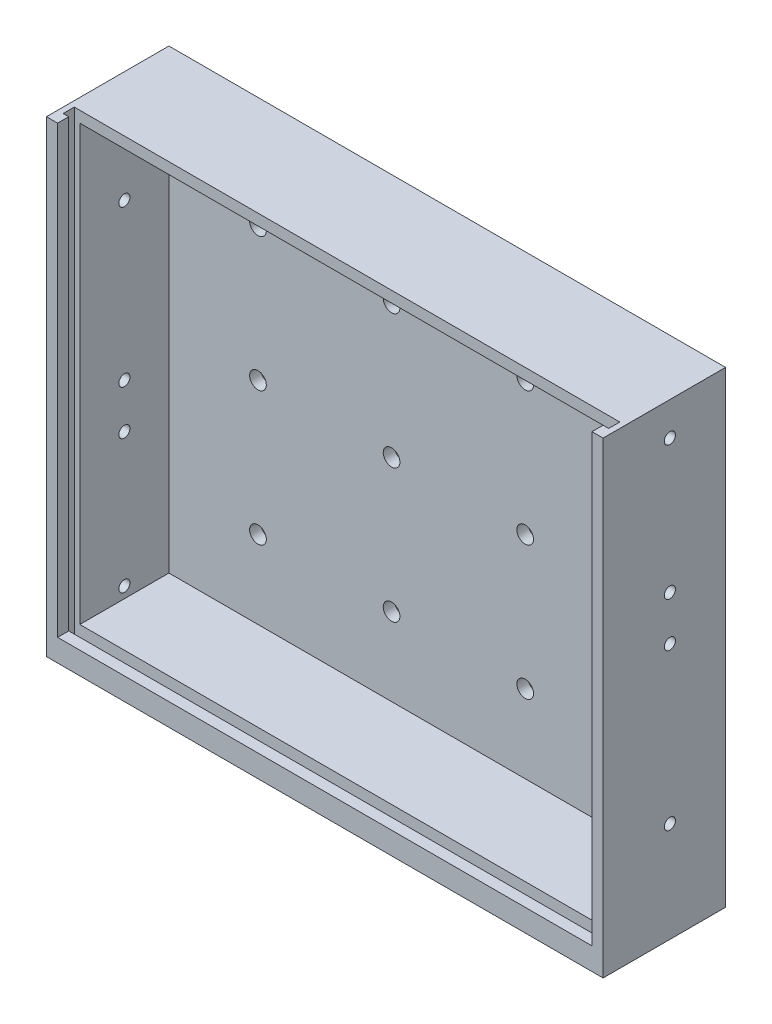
SolidWorks part; units mm, degrees
ref_plane "Front Plane" through (0, 0, 0) normal (0, 0, 1) x (1, 0, 0)
ref_plane "Top Plane" through (0, 0, 0) normal (0, 1, 0) x (1, 0, 0)
ref_plane "Right Plane" through (0, 0, 0) normal (1, 0, 0) x (0, 0, -1)
sketch "Sketch1" plane through (0, 0, 0) normal (0, 0, 1) x (1, 0, 0)
  line L1 (0, 0) -> (317.5, 0)
  line L2 (0, 0) -> (0, -266.7)
  line L3 (0, -266.7) -> (317.5, -266.7)
  line L4 (317.5, 0) -> (317.5, -266.7)
  dimension "D1" = 317.5
  dimension "D2" = 266.7
extrude "Boss-Extrude2" add sketch "Sketch1" along normal blind 6.35
sketch "Sketch4" plane through (0, 0, 6.35) normal (0, 0, 1) x (1, 0, 0)
  line L0 (6.35, 0) -> (6.35, -254)
  line L1 (317.5, 0) -> (0, 0) construction
  line L2 (311.15, -254) -> (311.15, 0)
  line L3 (317.5, 0) -> (317.5, -266.7)
  line L4 (317.5, -266.7) -> (0, -266.7)
  line L5 (0, -266.7) -> (0, 0)
  line L6 (0, 0) -> (6.35, 0)
  line L7 (6.35, -254) -> (311.15, -254)
  line L8 (311.15, 0) -> (317.5, 0)
  line L12 (0, 0) -> (0, -266.7)
  line L13 (0, -266.7) -> (317.5, -266.7)
  line L14 (317.5, -266.7) -> (317.5, 0)
  line L15 (317.5, 0) -> (0, 0)
  line L16 (0, 0) -> (0, -266.7)
  line L17 (0, -266.7) -> (317.5, -266.7)
  line L18 (317.5, -266.7) -> (317.5, 0)
  line L19 (311.15, 0) -> (0, 0)
  dimension "D1" = 304.8
  dimension "D2" = 6.35
  dimension "D3" = 254
  dimension "D5" = 6.35
  dimension "D4" = 0
extrude "Boss-Extrude5" add sketch "Sketch4" along normal blind 63.5 contours L7 L0 L2 M11 M8 M9 M10
sketch "Sketch6" plane through (0, 0, 0) normal (0, 1, 0) x (1, 0, 0)
  line L0 (3.175, -63.5) -> (3.175, -57.15)
  line L1 (3.175, -57.15) -> (314.325, -57.15)
  line L2 (314.325, -57.15) -> (314.325, -63.5)
  line L3 (314.325, -63.5) -> (3.175, -63.5)
  line L7 (6.35, -69.85) -> (0, -69.85) construction
  line L8 (0, -69.85) -> (0, 0) construction
  dimension "D1" = 311.15
  dimension "D2" = 6.35
  dimension "D3" = 6.35
  dimension "D4" = 3.175
extrude "Cut-Extrude2" cut sketch "Sketch6" against normal blind 314.325
sketch "Sketch7" plane through (0, 0, 6.35) normal (0, 0, 1) x (1, 0, 0)
  line L0 (0, 0) -> (0, -6.35)
  line L1 (0, 0) -> (0, -266.7) construction
  line L2 (0, -6.35) -> (317.5, -6.35)
  line L3 (317.5, -266.7) -> (317.5, 0) construction
  line L4 (317.5, -6.35) -> (317.5, 0)
  line L5 (317.5, 0) -> (0, 0)
  line L6 (0, -6.35) -> (0, 0)
  dimension "D1" = 6.35
extrude "Boss-Extrude6" add sketch "Sketch7" along normal blind 50.8 contours L2 M6 M4 M5
sketch "Sketch8" plane through (0, 0, 6.35) normal (0, 0, 1) x (1, 0, 0)
  line L0 (6.35, -6.35) -> (6.35, -254) construction
  line L1 (6.35, -6.35) -> (311.15, -6.35) construction
  line L2 (6.35, -6.35) -> (311.15, -6.35) construction
  circle A0 centre (57.15, -57.15) radius 4.7625
  circle A1 centre (209.55, -57.15) radius 4.7625
  circle A3 centre (57.15, -209.55) radius 4.7625
  circle A4 centre (209.55, -209.55) radius 4.7625
  dimension "D1" = 50.8
  dimension "D2" = 50.8
  dimension "D3" = 152.4
  dimension "D4" = 50.8
  dimension "D7" = 152.4
  dimension "D8" = 50.8
  dimension "D9" = 152.4
  dimension "D11" = 152.4
  dimension "D19" = 9.525
extrude "Cut-Extrude3" cut sketch "Sketch8" against normal blind 6.35
sketch "Sketch9" plane through (0, 0, 0) normal (-1, 0, 0) x (0, 0, 1)
  line L0 (69.85, 0) -> (0, 0) construction
  line L2 (0, 0) -> (0, -266.7) construction
  circle A0 centre (31.75, -57.15) radius 3.175
  circle A1 centre (31.75, -146.05) radius 3.175
  circle A2 centre (31.75, -171.45) radius 3.175
  circle A3 centre (31.75, -247.65) radius 3.175
  circle A4 centre (31.75, -273.05) radius 3.175
  dimension "D1" = 57.15
  dimension "D2" = 31.75
  dimension "D3" = 6.35
  dimension "D4" = 25.4
  dimension "D5" = 25.4
  dimension "D6" = 6.35
  dimension "D7" = 6.35
  dimension "D8" = 6.35
  dimension "D9" = 6.35
  dimension "D10" = 88.9
  dimension "D11" = 76.2
  dimension "D12" = 31.75
  dimension "D13" = 31.75
  dimension "D14" = 31.75
  dimension "D15" = 31.75
extrude "Cut-Extrude4" cut sketch "Sketch9" against normal blind 6.35
sketch "Sketch10" plane through (317.5, 0, 0) normal (1, 0, 0) x (0, 0, -1)
  line L0 (-69.85, -266.7) -> (0, -266.7) construction
  line L2 (0, -266.7) -> (0, 0) construction
  circle A0 centre (-31.75, -209.55) radius 3.175
  circle A1 centre (-31.75, -120.65) radius 3.175
  circle A2 centre (-31.75, -95.25) radius 3.175
  circle A3 centre (-31.75, -19.05) radius 3.175
  circle A4 centre (-31.75, 6.35) radius 3.175
  dimension "D1" = 57.15
  dimension "D2" = 31.75
  dimension "D3" = 6.35
  dimension "D4" = 6.35
  dimension "D5" = 6.35
  dimension "D6" = 6.35
  dimension "D7" = 6.35
  dimension "D8" = 146.05
  dimension "D9" = 25.4
  dimension "D10" = 101.6
  dimension "D11" = 101.6
  dimension "D12" = 31.75
  dimension "D13" = 31.75
  dimension "D14" = 31.75
  dimension "D15" = 31.75
extrude "Cut-Extrude5" cut sketch "Sketch10" against normal blind 6.35
sketch "Sketch11" plane through (0, 0, 0) normal (0, 0, -1) x (-1, 0, 0)
  line L0 (-57.15, -57.15) -> (-342.432, -57.15) construction
  line L1 (-57.15, -209.55) -> (-342.432, -209.55) construction
  line L2 (-57.15, -133.35) -> (-342.432, -133.35) construction
  line L3 (-57.15, -57.15) -> (-57.15, -209.55) construction
  dimension "D1" = 152.4
  dimension "D2" = 76.2
pattern_linear "LPattern3" count 2 spacing 76.2 along (0, -1, 0) of "Cut-Extrude3"
pattern_linear "LPattern4" count 2 spacing 76.2 along (1, 0, 0) of "LPattern3", "Cut-Extrude3"
